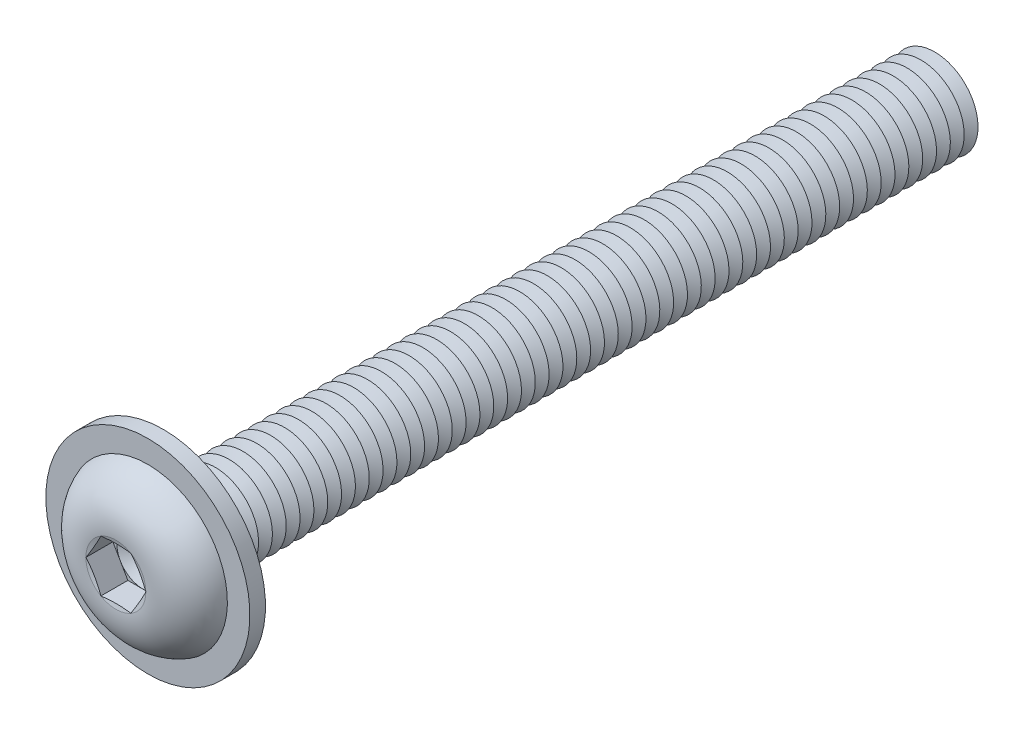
SolidWorks part; units mm, degrees
ref_plane "Front Plane" through (0, 0, 0) normal (0, 0, 1) x (1, 0, 0)
ref_plane "Top Plane" through (0, 0, 0) normal (0, 1, 0) x (1, 0, 0)
ref_plane "Right Plane" through (0, 0, 0) normal (1, 0, 0) x (0, 0, -1)
sketch "Sketch1" plane through (0, 0, 0) normal (1, 0, 0) x (0, 0, -1)
  line L0 (0, 2.5) -> (0, 4.75)
  line L3 (0, 2.5) -> (45, 2.5)
  line L4 (45, 2.5) -> (45, 0)
  line L5 (45, 0) -> (-2.75, 0) construction
  line L6 (-2.75, 0) -> (45, 0)
  line L7 (-2.75, 1.732) -> (-2.75, 0.866) construction
  line L8 (-2.75, 0.866) -> (-2.75, 0)
  line L9 (-2.75, 1.732) -> (-2.5179, 0.866)
  line L10 (-2.5179, 0.866) -> (-2.75, 0.866)
  line L11 (45, 0) -> (22.7481, 0) construction
  line L12 (0, 4.75) -> (-2.75, 4.75) construction
  arc A1 (0, 4.75) -> (-2.75, 1.732) centre (0, 1.9881) ccw
  point P8 (45, 1.25)
  dimension "D1" = 9.5
  dimension "D2" = 5
  dimension "D3" = 2.75
  dimension "D4" = 3.4641
  dimension "D5" = 45
  dimension "D6" = 15
revolve "Revolve1" add sketch "Sketch1" angle 360 about L5
fillet "Fillet1" radius 0.4 1 edges at (0, 2.5, 0)
sketch "Sketch2" plane through (0, 0, 0) normal (1, 0, 0) x (0, 0, -1)
  line L0 (44.6, 2.5) -> (45.4, 2.5)
  line L1 (45, 2.5) -> (0.4, 2.5) construction
  line L2 (45.4, 2.5) -> (45, 1.8072)
  line L3 (45, -2.5) -> (45, 2.5) construction
  line L4 (45, 1.8072) -> (44.6, 2.5)
  dimension "D1" = 0.8
revolve "Cut-Revolve1" cut sketch "Sketch2" angle 360 about axis through (0, 0, -45) along (0, 0, -1)
pattern_linear "LPattern1" count 56 spacing 0.8 along (0, 0, 1) of "Cut-Revolve1"
sketch "Sketch3" plane through (0, 0, 2.75) normal (0, 0, 1) x (1, 0, 0)
  line L7 (0.866, 1.5) -> (-0.866, 1.5)
  line L8 (-0.866, 1.5) -> (-1.7321, 0)
  line L9 (-1.7321, 0) -> (-0.866, -1.5)
  line L10 (-0.866, -1.5) -> (0.866, -1.5)
  line L11 (0.866, -1.5) -> (1.732, 0)
  line L12 (1.732, 0) -> (0.866, 1.5)
  circle A0 centre (0, 0) radius 1.5 construction
  circle A3 centre (0, 0) radius 1.7321 construction
extrude "Cut-Extrude1" cut sketch "Sketch3" against normal blind 1.56
sketch "Sketch4" plane through (0, 0, 1.19) normal (0, 0, 1) x (1, 0, 0)
  line L1 (0.866, 1.5) -> (-0.866, 1.5) construction
  circle A0 centre (0, 0) radius 1.5
extrude "Cut-Extrude2" cut sketch "Sketch4" against normal through all draft 60
sketch "Sketch5" plane through (0, 0, 0) normal (0, 0, -1) x (-1, 0, 0)
  circle A0 centre (0, 0) radius 5.9
  circle A1 centre (0, 0) radius 2.9
  circle A2 centre (0, 0) radius 2.9 construction
  dimension "D1" = 11.8
extrude "Boss-Extrude1" add sketch "Sketch5" against normal blind 0.9
